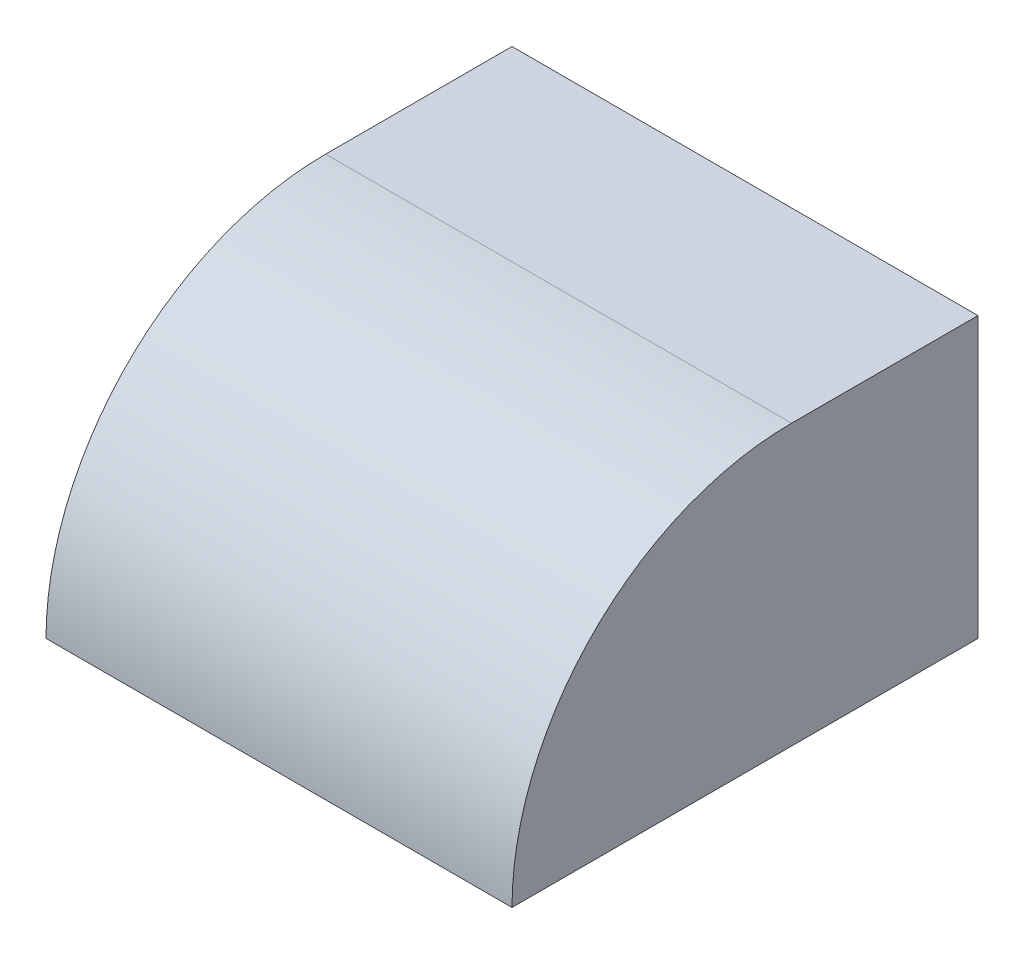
SolidWorks part; units mm, degrees
ref_plane "Front Plane" through (0, 0, 0) normal (0, 0, 1) x (1, 0, 0)
ref_plane "Top Plane" through (0, 0, 0) normal (0, 1, 0) x (1, 0, 0)
ref_plane "Right Plane" through (0, 0, 0) normal (1, 0, 0) x (0, 0, -1)
sketch "Sketch1" plane through (0, 0, 0) normal (0, 0, 1) x (1, 0, 0)
  line L1 (0, 0) -> (50, 0)
  line L2 (0, 0) -> (0, 30)
  line L3 (0, 30) -> (50, 30)
  line L4 (50, 0) -> (50, 30)
  dimension "D1" = 50
  dimension "D2" = 30
extrude "Extrude1" add sketch "Sketch1" along normal blind 50
sketch "Sketch4" plane through (0, 30, 0) normal (0, 1, 0) x (-1, 0, 0)
  line L0 (-25, 0) -> (-25, 50) construction
  line L1 (-50, 0) -> (0, 0) construction
  line L2 (-50, 50) -> (0, 50) construction
  circle A0 centre (-25, 30) radius 7.5
  dimension "D1" = 20
  dimension "D2" = 15
extrude "Extrude4" add sketch "Sketch4" along normal blind 10
sketch "Sketch5" plane through (0, 30, 0) normal (0, 1, 0) x (-1, 0, 0)
  line L0 (-50, 50) -> (-50, 0) construction
  line L1 (-50, 50) -> (0, 50) construction
  circle A0 centre (-40, 40) radius 5
  dimension "D3" = 10
  dimension "D1" = 10
  dimension "D2" = 10
extrude "Cut-Extrude1" cut sketch "Sketch5" against normal blind 10
fillet "Fillet7" radius 30 1 edges at (25, 30, 50)
